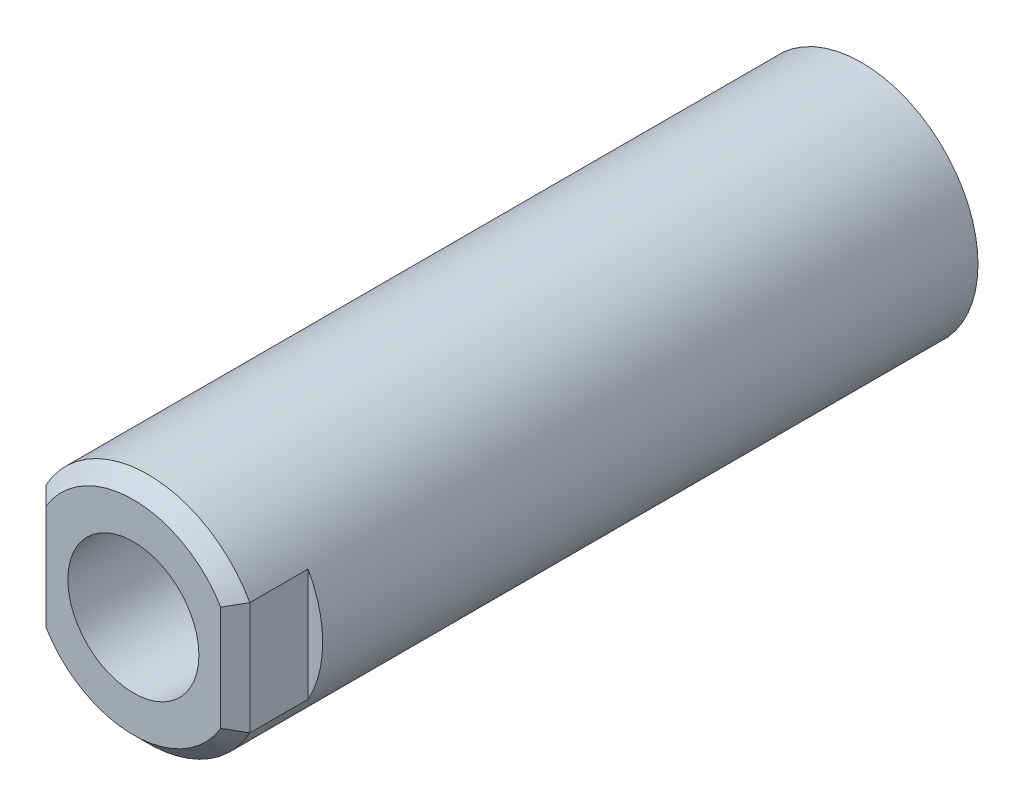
SolidWorks part; units mm, degrees
ref_plane "Front Plane" through (0, 0, 0) normal (0, 0, 1) x (1, 0, 0)
ref_plane "Top Plane" through (0, 0, 0) normal (0, 1, 0) x (1, 0, 0)
ref_plane "Right Plane" through (0, 0, 0) normal (1, 0, 0) x (0, 0, -1)
sketch "Sketch1" plane through (0, 0, 0) normal (0, 0, 1) x (1, 0, 0)
  circle A0 centre (0, 0) radius 8
  dimension "D1" = 16
extrude "Extrude1" add sketch "Sketch1" against normal blind 50
sketch "Sketch2" plane through (0, 0, 0) normal (0, 0, 1) x (1, 0, 0)
  circle A0 centre (0, 0) radius 8
  circle A1 centre (0, 0) radius 8 construction
  dimension "D1" = 16
extrude "Extrude2" add sketch "Sketch2" along normal blind 8
hole_wizard "M10x1.0 Tapped Hole1" positions "3DSketch1" profile "Sketch5" tap size "M10x1.0" standard "Ansi Metric"
sketch3d "3DSketch1"
  circle A0 centre (0, 0, 8) radius 8 construction
  point P0 (0, 0, 8)
  point P5 (0, 0, 16)
sketch "Sketch5" plane through (0, 0, 8) normal (1, 0, 0) x (0, -1, 0)
  line L0 (0, 0) -> (0, 24.7039)
  line L1 (0, 24.7039) -> (4.5, 22)
  line L2 (4.5, 22) -> (4.5, 0)
  line L5 (4.5, 0) -> (0, 0)
  line L10 (0, 24.7039) -> (-4.5, 22) construction
  line L11 (0, -6.35) -> (0, 107.95) construction
  dimension "Tap Drill Dia." = 9
  dimension "Tap Drill Depth" = 22
  dimension "Drill Angle" = 118
chamfer "Chamfer2" distance 0.5 angle 45 1 edges at (8, 0, 8)
sketch "Sketch8" plane through (0, 0, 0) normal (0, 0, 1) x (1, 0, 0)
  circle A0 centre (0, 0) radius 7.5
  circle A1 centre (0, 0) radius 8
  circle A3 centre (0, 0) radius 8 construction
  dimension "D1" = 15
  dimension "D2" = 16
extrude "Cut-Extrude3" cut sketch "Sketch8" along normal blind 1
sketch "Sketch7" plane through (0, 0, 0) normal (0, 1, 0) x (1, 0, 0)
  line L0 (-9.5, 0) -> (-7, 0)
  line L2 (7, 0) -> (7, 5)
  line L3 (7, 5) -> (9.5, 5)
  line L4 (9.5, 0) -> (9.5, 5)
  line L5 (-9.5, 5) -> (-7, 5)
  line L6 (-9.5, 0) -> (-9.5, 5)
  line L7 (7, 0) -> (9.5, 0)
  line L8 (-7, 0) -> (-7, 5)
  line L9 (-7.5, 0) -> (7.5, 0) construction
  line L10 (0, 50) -> (0, 0) construction
  line L11 (0, 0) -> (0, -8) construction
  line L12 (0, -1) -> (0, -7.5) construction
  line L14 (0, 14) -> (0, -8) construction
  line L15 (-7.5, -8) -> (7.5, -8) construction
  dimension "D1" = 7
  dimension "D2" = 14
  dimension "D3" = 8
  dimension "D4" = 19
  dimension "D5" = 5
  dimension "D7" = 9.5
extrude "Cut-Extrude4" cut sketch "Sketch7" against normal mid plane 20
sketch "Sketch9" plane through (0, 0, 8) normal (0, 0, 1) x (1, 0, 0)
  circle A0 centre (0, 0) radius 8
extrude "Cut-Extrude5" cut sketch "Sketch9" against normal up to surface (8 mm away)
chamfer "Chamfer3" distance 1 angle 45 4 edges at (0, 8, 0) (0, -8, 0) (-7, 0, 0) (7, 0, 0)
equation "\"D4@Sketch7\" = \"D2@Sketch7\"+5"
equation "\"D1@Sketch7\"=\"D2@Sketch7\"/2"
equation "\"D1@Sketch8\" = \"D2@Sketch8\" -1"
equation "\"D5@Sketch7\" = \"D3@Sketch7\"-3"
equation "\"D7@Sketch7\" = \"D4@Sketch7\"/2"
